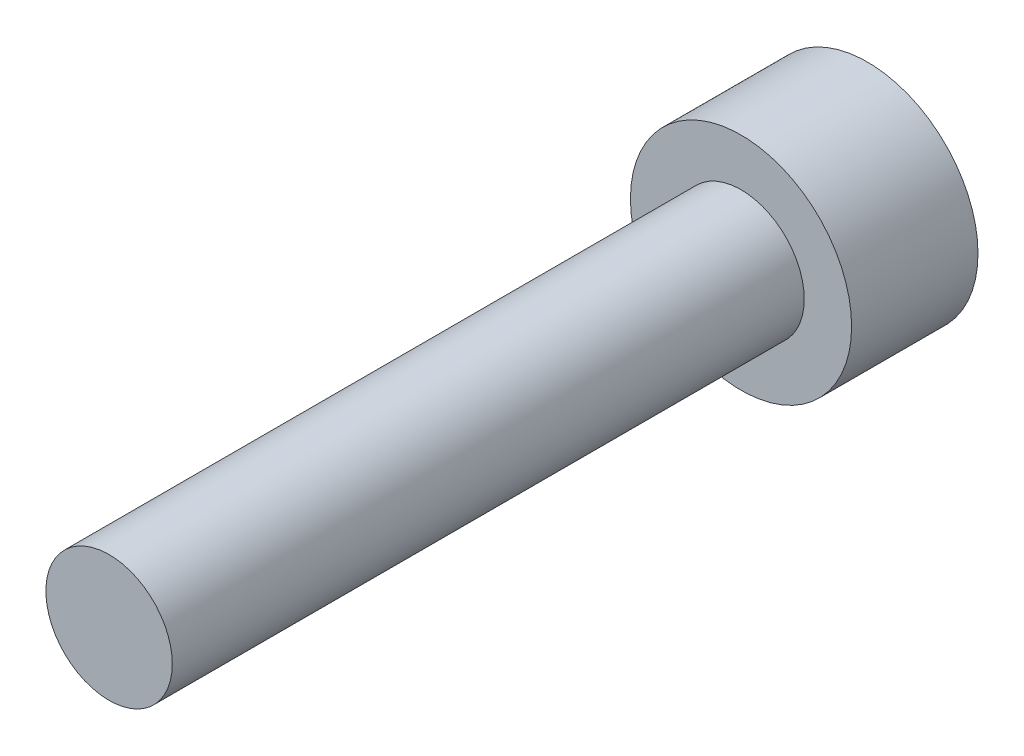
SolidWorks part; units mm, degrees
ref_plane "Front Plane" through (0, 0, 0) normal (0, 0, 1) x (1, 0, 0)
ref_plane "Top Plane" through (0, 0, 0) normal (0, 1, 0) x (1, 0, 0)
ref_plane "Right Plane" through (0, 0, 0) normal (1, 0, 0) x (0, 0, -1)
sketch "Sketch6" plane through (0, 0, 0) normal (1, 0, 0) x (0, 0, -1)
  line L0 (-20, 0) -> (22.525, 0) construction
  line L1 (3.85, 0) -> (-3.85, 0) construction
  line L2 (-20, 0) -> (-20, -2)
  line L3 (-20, -2) -> (0, -2)
  line L4 (0, 3.85) -> (0, -3.85) construction
  line L5 (0, -2) -> (0, -3.5)
  line L6 (0, -3.5) -> (4, -3.5)
  line L7 (4, -3.5) -> (4, 0)
  line L8 (4, 0) -> (-20, 0)
  dimension "L" = 20
  dimension "H" = 4
  dimension "A" = 7
  dimension "D" = 4
revolve "Revolve1" add sketch "Sketch6" angle 360 about L0
sketch "Sketch7" plane through (0, 0, -4) normal (0, 0, -1) x (-1, 0, 0)
  line L2 (-1.5, 0.866) -> (-1.5, -0.866)
  line L4 (-1.5, -0.866) -> (0, -1.7321)
  line L5 (0, -1.7321) -> (1.5, -0.866)
  line L6 (1.5, -0.866) -> (1.5, 0.866)
  line L7 (1.5, 0.866) -> (0, 1.7321)
  line L8 (0, 1.7321) -> (-1.5, 0.866)
  circle A0 centre (0, 0) radius 1.5 construction
  dimension "J" = 3
extrude "HEX" cut sketch "Sketch7" against normal blind 3
